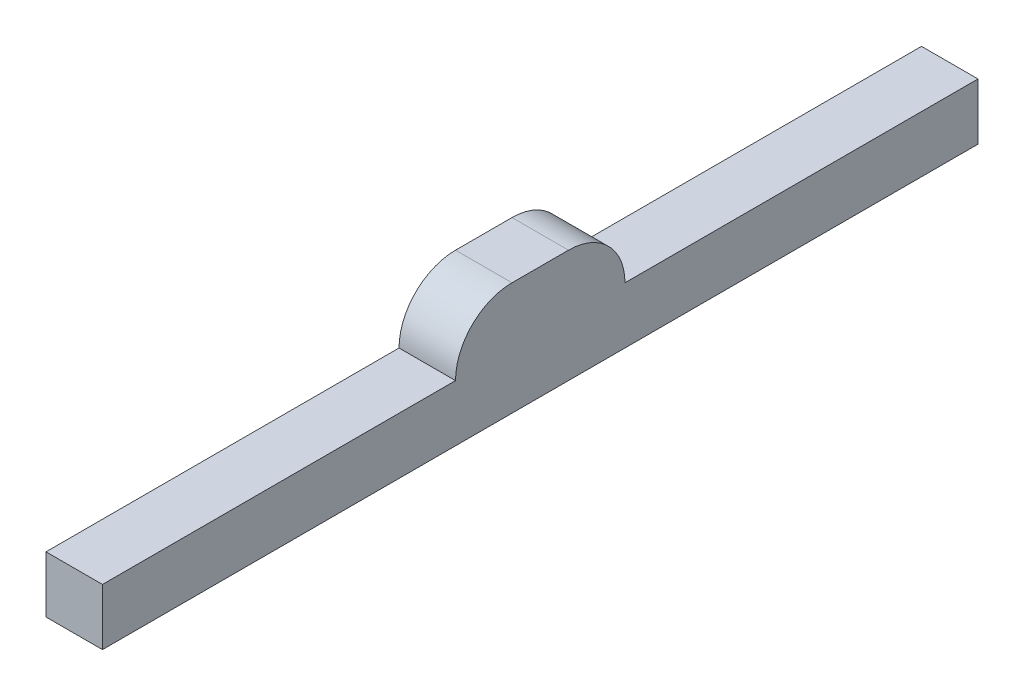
SolidWorks part; units mm, degrees
ref_plane "Ebene vorne" through (0, 0, 0) normal (0, 0, 1) x (1, 0, 0)
ref_plane "Ebene oben" through (0, 0, 0) normal (0, 1, 0) x (1, 0, 0)
ref_plane "Ebene rechts" through (0, 0, 0) normal (1, 0, 0) x (0, 0, -1)
sketch "Skizze1" plane through (0, 0, 0) normal (0, 0, 1) x (1, 0, 0)
  line L1 (0, 0) -> (2, 0)
  line L2 (0, 0) -> (0, 2)
  line L3 (0, 2) -> (2, 2)
  line L4 (2, 0) -> (2, 2)
  dimension "D1" = 2
  dimension "D2" = 2
extrude "Aufsatz-Linear austragen1" add sketch "Skizze1" along normal blind 31
sketch "Skizze2" plane through (0, 2, 0) normal (0, 1, 0) x (1, 0, 0)
  line L0 (0, -15.5) -> (2, -15.5) construction
  line L1 (0, -31) -> (0, 0) construction
  line L2 (2, -31) -> (2, 0) construction
  line L3 (1, 0) -> (1, -31) construction
  line L4 (2, 0) -> (0, 0) construction
  line L5 (2, -31) -> (0, -31) construction
  line L7 (0, -18.5) -> (2, -18.5)
  line L8 (0, -18.5) -> (0, -12.5)
  line L9 (0, -12.5) -> (2, -12.5)
  line L10 (2, -18.5) -> (2, -12.5)
  line L11 (0, -18.5) -> (2, -12.5) construction
  line L12 (0, -12.5) -> (2, -18.5) construction
  point P12 (1, -15.5)
  dimension "D1" = 6
extrude "Aufsatz-Linear austragen2" add sketch "Skizze2" along normal blind 2
fillet "Verrundung1" radius 2 2 edges at (1, 4, 12.5) (1, 4, 18.5)
